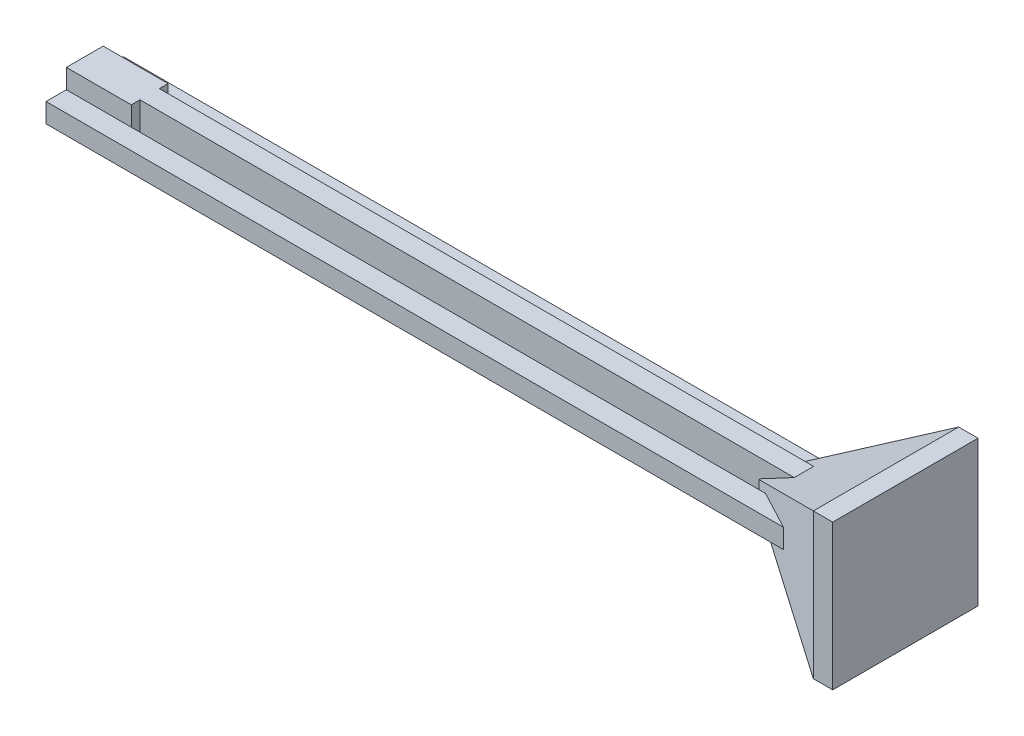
SolidWorks part; units mm, degrees
ref_plane "Plan de face" through (0, 0, 0) normal (0, 0, 1) x (1, 0, 0)
ref_plane "Plan de dessus" through (0, 0, 0) normal (0, 1, 0) x (1, 0, 0)
ref_plane "Plan de droite" through (0, 0, 0) normal (1, 0, 0) x (0, 0, -1)
sketch "Esquisse1" plane through (0, 0, 0) normal (0, 1, 0) x (1, 0, 0)
  line L1 (-2.15, 0.7) -> (2.15, 0.7)
  line L2 (-2.15, 0.7) -> (-2.15, -0.7)
  line L3 (-2.15, -0.7) -> (2.15, -0.7)
  line L4 (2.15, 0.7) -> (2.15, -0.7)
  line L5 (-2.15, 0.7) -> (2.15, -0.7) construction
  line L6 (-2.15, -0.7) -> (2.15, 0.7) construction
  line L7 (-3.35, 1.9) -> (3.35, 1.9)
  line L8 (-3.35, 1.9) -> (-3.35, -1.9)
  line L9 (-3.35, -1.9) -> (3.35, -1.9)
  line L10 (3.35, 1.9) -> (3.35, -1.9)
  line L11 (-3.35, 1.9) -> (3.35, -1.9) construction
  line L12 (-3.35, -1.9) -> (3.35, 1.9) construction
  point P0 (0, 0)
  point P6 (0, 0)
  dimension "D1" = 4.3
  dimension "D2" = 1.4
  dimension "D3" = 1.2
  dimension "D4" = 1.2
extrude "Boss.-Extru.1" add sketch "Esquisse1" along normal blind 4
sketch "Esquisse2" plane through (3.35, 0, 0) normal (1, 0, 0) x (0, 0, -1)
  line L1 (-1.9, 4) -> (1.9, 4)
  line L2 (-1.9, 4) -> (-1.9, 6)
  line L3 (-1.9, 6) -> (1.9, 6)
  line L4 (1.9, 4) -> (1.9, 6)
  dimension "D1" = 2
extrude "Boss.-Extru.2" add sketch "Esquisse2" against normal up to surface (6.7 mm away)
sketch "Esquisse3" plane through (3.35, 0, 0) normal (1, 0, 0) x (0, 0, -1)
  line L0 (1.9, 6) -> (-1.9, 6) construction
  line L8 (-1, 0) -> (1, 0)
  line L9 (1, 0) -> (1, 6)
  line L10 (1, 6) -> (-1, 6)
  line L11 (-1, 6) -> (-1, 0)
  point P6 (0, 6)
  point P7 (0, 6)
  dimension "D1" = 2
extrude "Boss.-Extru.3" add sketch "Esquisse3" along normal blind 76
sketch "Esquisse4" plane through (79.35, 0, 0) normal (1, 0, 0) x (0, 0, -1)
  line L0 (0, 6) -> (0, 0) construction
  line L1 (1, 6) -> (-1, 6) construction
  line L2 (-1, 0) -> (1, 0) construction
  line L4 (-7.5, 10.5) -> (7.5, 10.5)
  line L5 (-7.5, 10.5) -> (-7.5, -4.5)
  line L6 (-7.5, -4.5) -> (7.5, -4.5)
  line L7 (7.5, 10.5) -> (7.5, -4.5)
  line L8 (-7.5, 10.5) -> (7.5, -4.5) construction
  line L9 (-7.5, -4.5) -> (7.5, 10.5) construction
  point P6 (0, 3)
  dimension "D1" = 15
  dimension "D2" = 15
extrude "Boss.-Extru.4" add sketch "Esquisse4" against normal blind 12 draft 28
sketch "Esquisse5" plane through (-3.35, 0, 0) normal (-1, 0, 0) x (0, 0, 1)
  line L0 (-1.9, 3) -> (1.9, 3) construction
  line L1 (-1.9, 6) -> (-1.9, 0) construction
  line L2 (1.9, 6) -> (1.9, 0) construction
  line L3 (-1.9, 2) -> (-1.9, 4)
  line L4 (4, 2) -> (1.9, 2)
  line L5 (4, 2) -> (4, 4)
  line L6 (4, 4) -> (1.9, 4)
  line L7 (-4, 2) -> (-4, 4)
  line L8 (4, 2) -> (-4, 4) construction
  line L9 (4, 4) -> (-4, 2) construction
  line L10 (1.9, 2) -> (1.9, 4)
  line L11 (-1.9, 4) -> (-4, 4)
  line L12 (-1.9, 2) -> (-4, 2)
  point P6 (0, 3)
  dimension "D1" = 8
  dimension "D2" = 2
extrude "Boss.-Extru.5" add sketch "Esquisse5" against normal blind 78
sketch "Esquisse6" plane through (79.35, 0, 0) normal (1, 0, 0) x (0, 0, -1)
  line L4 (7.5, -4.5) -> (7.5, 10.5)
  line L5 (7.5, 10.5) -> (-7.5, 10.5)
  line L6 (-7.5, 10.5) -> (-7.5, -4.5)
  line L7 (-7.5, -4.5) -> (7.5, -4.5)
  line L8 (7.5, -4.5) -> (7.5, 10.5)
  line L9 (7.5, 10.5) -> (-7.5, 10.5)
  line L10 (-7.5, 10.5) -> (-7.5, -4.5)
  line L11 (-7.5, -4.5) -> (7.5, -4.5)
  dimension "D1" = 0
extrude "Boss.-Extru.6" add sketch "Esquisse6" along normal blind 2
